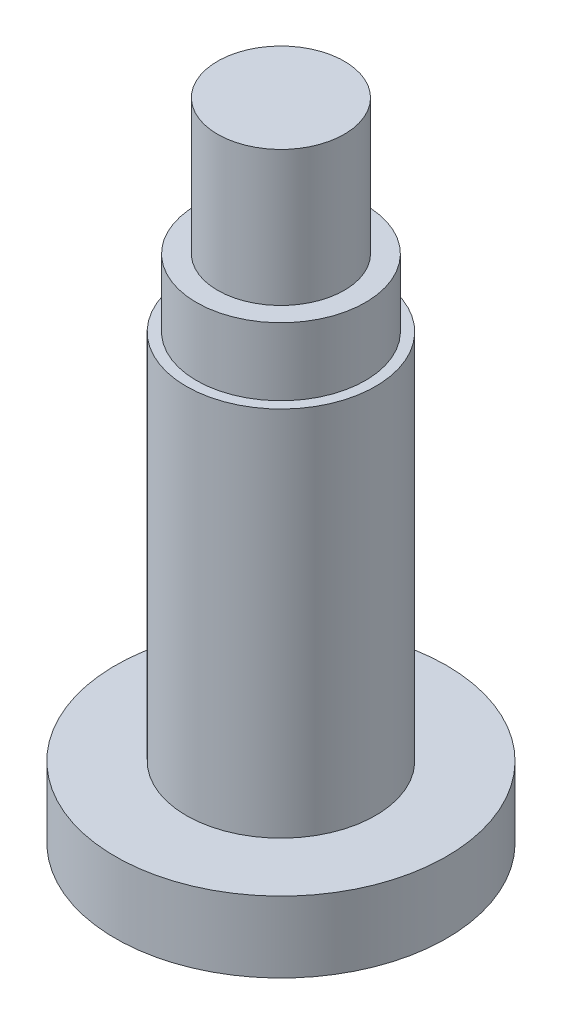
SolidWorks part; units mm, degrees
ref_plane "Front Plane" through (0, 0, 0) normal (0, 0, 1) x (1, 0, 0)
ref_plane "Top Plane" through (0, 0, 0) normal (0, 1, 0) x (1, 0, 0)
ref_plane "Right Plane" through (0, 0, 0) normal (1, 0, 0) x (0, 0, -1)
sketch "Sketch1" plane through (0, 0, 0) normal (0, 1, 0) x (1, 0, 0)
  circle A0 centre (0, 0) radius 12.446
  dimension "D1" = 24.892
extrude "Extrude1" add sketch "Sketch1" along normal blind 6.604
sketch "Sketch2" plane through (0, 6.604, 0) normal (0, 1, 0) x (-1, 0, 0)
  circle A0 centre (0, 0) radius 7.112
extrude "Extrude2" add sketch "Sketch2" along normal blind 27.94
sketch "Sketch3" plane through (0, 34.544, 0) normal (0, 1, 0) x (-1, 0, 0)
  circle A0 centre (0, 0) radius 6.35
  dimension "D1" = 12.7
extrude "Extrude3" add sketch "Sketch3" along normal blind 5.08
sketch "Sketch4" plane through (0, 39.624, 0) normal (0, 1, 0) x (-1, 0, 0)
  circle A0 centre (0, 0) radius 4.7625
extrude "Extrude4" add sketch "Sketch4" along normal blind 10.16
sketch "Sketch5" plane through (0, 0, 0) normal (0, -1, 0) x (1, 0, 0)
  circle A0 centre (0, 0) radius 6.5024
  dimension "D1" = 13.0048
extrude "Cut-Extrude1" cut sketch "Sketch5" against normal blind 24.892
sketch "Sketch6" plane through (0, 24.892, 0) normal (0, -1, 0) x (1, 0, 0)
  circle A0 centre (0, 0) radius 1.27
  dimension "D1" = 2.54
extrude "Extrude5" add sketch "Sketch6" along normal blind 0.762
sketch "Sketch7" plane through (0, 0, 0) normal (0, -1, 0) x (1, 0, 0)
  circle A0 centre (0, 0) radius 9.017
  dimension "D1" = 18.034
extrude "Cut-Extrude2" cut sketch "Sketch7" against normal blind 1.27 flip side to cut
